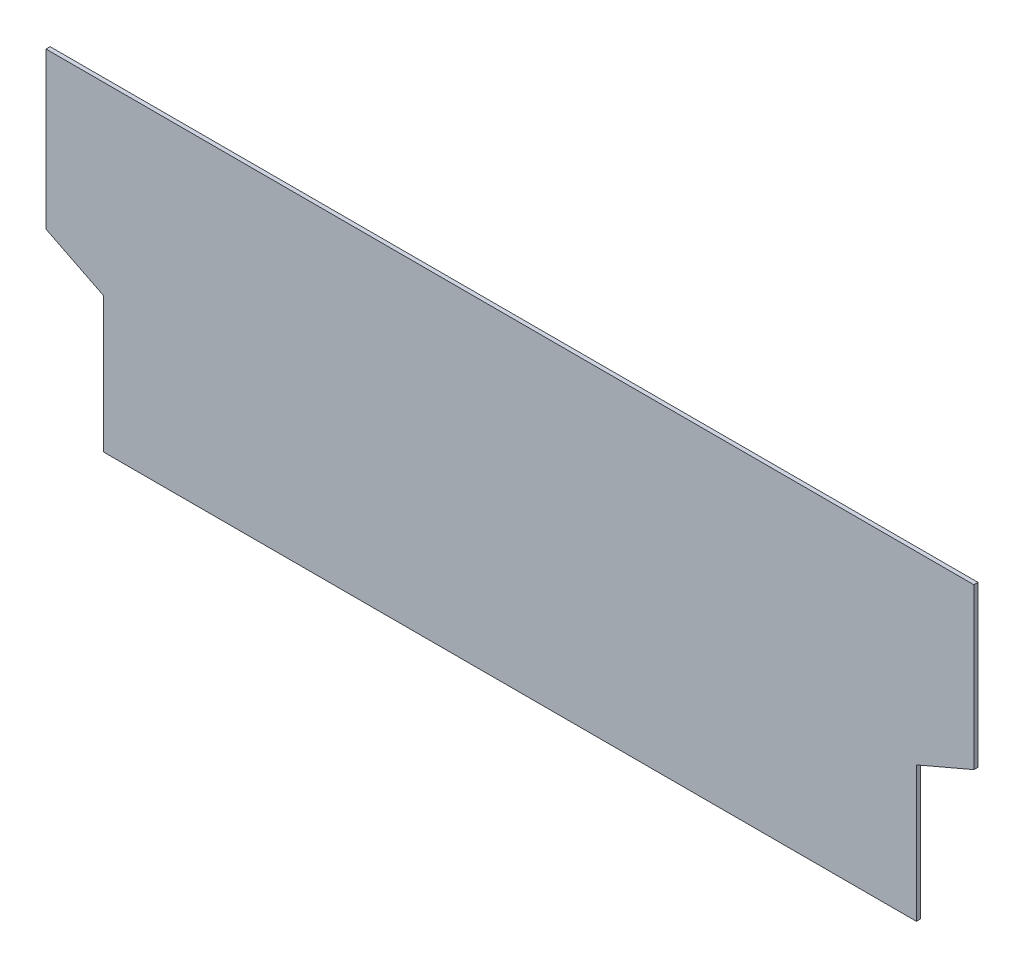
SolidWorks part; units mm, degrees
ref_plane "Front" through (0, 0, 0) normal (0, 0, 1) x (1, 0, 0)
ref_plane "Top" through (0, 0, 0) normal (0, 1, 0) x (1, 0, 0)
ref_plane "Right" through (0, 0, 0) normal (1, 0, 0) x (0, 0, -1)
sketch "草图1" plane through (0, 0, 0) normal (0, 0, 1) x (1, 0, 0)
  line L0 (-97.0727, 64.2545) -> (-97.0727, 26.2545)
  line L1 (-97.0727, 64.2545) -> (128.9273, 64.2545)
  line L7 (-97.0727, 26.2545) -> (-83.0727, 19.2545)
  line L8 (-83.0727, 19.2545) -> (-83.0727, -13.7455)
  line L9 (114.9273, 19.2545) -> (114.9273, -13.7455)
  line L10 (128.9273, 25.2545) -> (128.9273, 64.2545)
  line L14 (-83.0727, -13.7455) -> (114.9273, -13.7455)
  line L15 (114.9273, 19.2545) -> (128.9273, 25.2545)
  dimension "D1" = 226
  dimension "D2" = 198
  dimension "D3" = 38
extrude "凸台-拉伸1" add sketch "草图1" along normal blind 1 contours L1 L10 L15 L9 L14 L8 L7 L0
